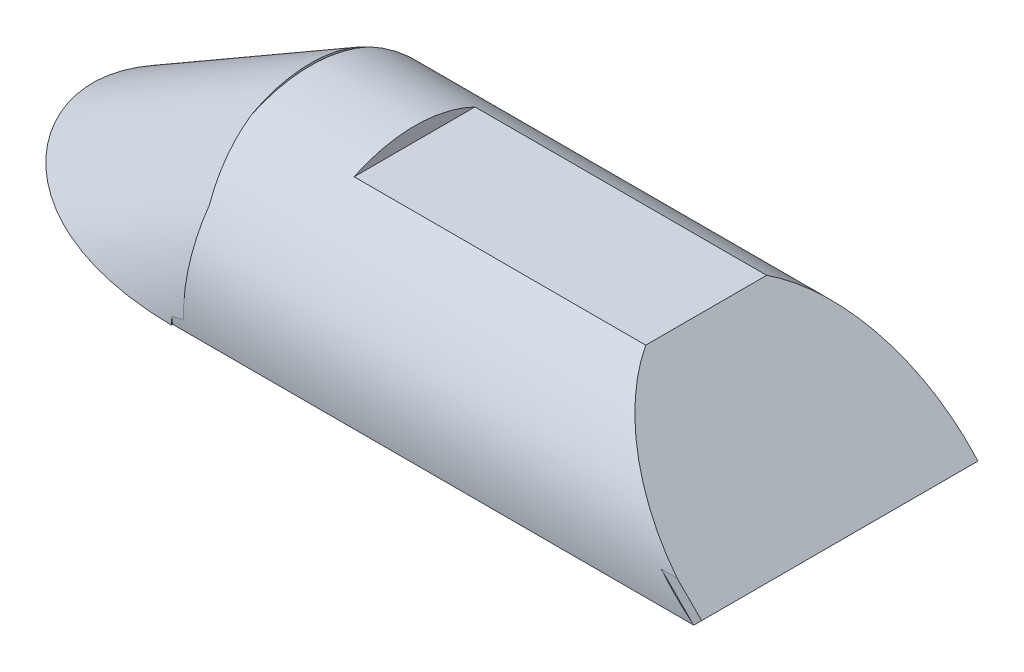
SolidWorks part; units mm, degrees
ref_plane "Front Plane" through (0, 0, 0) normal (0, 0, 1) x (1, 0, 0)
ref_plane "Top Plane" through (0, 0, 0) normal (0, 1, 0) x (1, 0, 0)
ref_plane "Right Plane" through (0, 0, 0) normal (1, 0, 0) x (0, 0, -1)
sketch "Sketch2" plane through (0, 0, 0) normal (0, 0, 1) x (1, 0, 0)
  line L0 (-60.0149, 0) -> (45.4413, 0) construction
  line L1 (-60.0149, 0) -> (-28.0776, -55.3169) construction
  dimension "D1" = 60
sketch "Sketch4" plane through (0, 0, 0) normal (0, 1, 0) x (1, 0, 0)
  point P1 (-60.0149, -50.6914)
ref_plane "Plane1" through (-45.0111, -25.9872, 0) normal (-0.866, -0.5, 0) x (0, 0, 1)
sketch "Sketch5" plane through (-45.0111, -25.9872, 0) normal (-0.866, -0.5, 0) x (0, 0, 1)
  circle A0 centre (0, 0) radius 12.7
  dimension "D1" = 25.4
extrude "Extrude1" add sketch "Sketch5" against normal blind 101.6
sketch "Sketch6" plane through (-45.0111, -25.9872, 0) normal (-0.866, -0.5, 0) x (0, 0, 1)
  circle A0 centre (0, 0) radius 9.525
  dimension "D1" = 19.05
extrude "Cut-Extrude1" cut sketch "Sketch6" against normal through all
sketch "Sketch7" plane through (0, 0, 0) normal (0, 0, 1) x (1, 0, 0)
  line L0 (-44.4387, -26.9788) -> (42.977, 24.8128) construction
  line L1 (47.7395, 16.5639) -> (38.2145, 33.0617) construction
  line L2 (-60.0149, 0) -> (45.4413, 0) construction
  line L3 (1.0971, 24.8128) -> (-48.4974, 24.8128)
  line L4 (1.0971, 24.8128) -> (1.0971, 0)
  line L5 (1.0971, 0) -> (-48.4974, 0)
  line L6 (-48.4974, 24.8128) -> (-48.4974, 0)
extrude "Cut-Extrude3" cut sketch "Sketch7" against normal through all and the other way through all flip side to cut
sketch "Sketch8" plane through (1.0971, 0, 0) normal (1, 0, 0) x (0, 0, -1)
  line L0 (-9.525, 0) -> (9.525, 0) construction
  circle A0 centre (0, 1.778) radius 12.7
  dimension "D1" = 25.4
  dimension "D2" = 1.778
extrude "Extrude2" add sketch "Sketch8" along normal blind 101.6
sketch "Sketch10" plane through (102.6971, 0, 0) normal (1, 0, 0) x (0, 0, -1)
  circle A0 centre (0, 1.778) radius 9.525
  dimension "D1" = 19.05
extrude "Cut-Extrude5" cut sketch "Sketch10" against normal blind 101.6
sketch "Sketch12" plane through (102.6971, 0, 0) normal (1, 0, 0) x (0, 0, -1)
  line L0 (0, 0) -> (0, -55.3169) construction
  circle A0 centre (0, -25.9097) radius 29.083
  dimension "D1" = 58.166
extrude "Cut-Extrude6" cut sketch "Sketch12" against normal through all
sketch "Sketch13" plane through (0, 0, 0) normal (0, 0, 1) x (1, 0, 0)
  line L0 (29.9793, 18.0173) -> (53.8043, -5.8078)
  line L1 (53.8043, -5.8078) -> (105.2851, -5.8078)
  line L2 (105.2851, -5.8078) -> (105.2851, 19.8859)
  line L3 (105.2851, 19.8859) -> (29.9793, 18.0173)
extrude "Cut-Extrude9" cut sketch "Sketch13" against normal through all and the other way through all
sketch "Sketch14" plane through (23.9983, 23.9983, 0) normal (0.7071, 0.7071, 0) x (-0.7071, 0.7071, 0)
  line L1 (-33.5204, 12.6132) -> (-13.4637, 12.6132)
  line L2 (-33.5204, 12.6132) -> (-33.5204, -12.7)
  line L3 (-33.5204, -12.7) -> (-13.4637, -12.7)
  line L4 (-13.4637, 12.6132) -> (-13.4637, -12.7)
extrude "Extrude3" add sketch "Sketch14" along normal blind 1.016
sketch "Sketch15" plane through (0, 0, 0) normal (1, 0, 0) x (0, 0, -1)
  circle A0 centre (0, 1.778) radius 12.7
  dimension "D1" = 25.4
extrude "Cut-Extrude10" cut sketch "Sketch15" along normal through all flip side to cut
sketch "Sketch16" plane through (0, 0, 0) normal (0, 0, 1) x (1, 0, 0)
  line L0 (48.4004, 18.0277) -> (48.4004, -6.8741) construction
sketch "Sketch17" plane through (0, 0, 0) normal (0, 1, 0) x (1, 0, 0)
  point P0 (48.4192, -26.374)
ref_plane "Plane2" through (48.4004, 0, -0.0344) normal (-1, 0, 0.0007) x (0.0007, 0, 1)
sketch "Sketch19" plane through (48.4004, 0, -0.0344) normal (-1, 0, 0.0007) x (0.0007, 0, 1)
  line L1 (7.478, 21.8822) -> (-7.342, 21.8822)
  line L2 (7.478, 21.8822) -> (7.478, 13.2098)
  line L3 (7.478, 13.2098) -> (-7.342, 13.2098)
  line L4 (-7.342, 21.8822) -> (-7.342, 13.2098)
extrude "Cut-Extrude11" cut sketch "Sketch19" along normal blind 38.862
